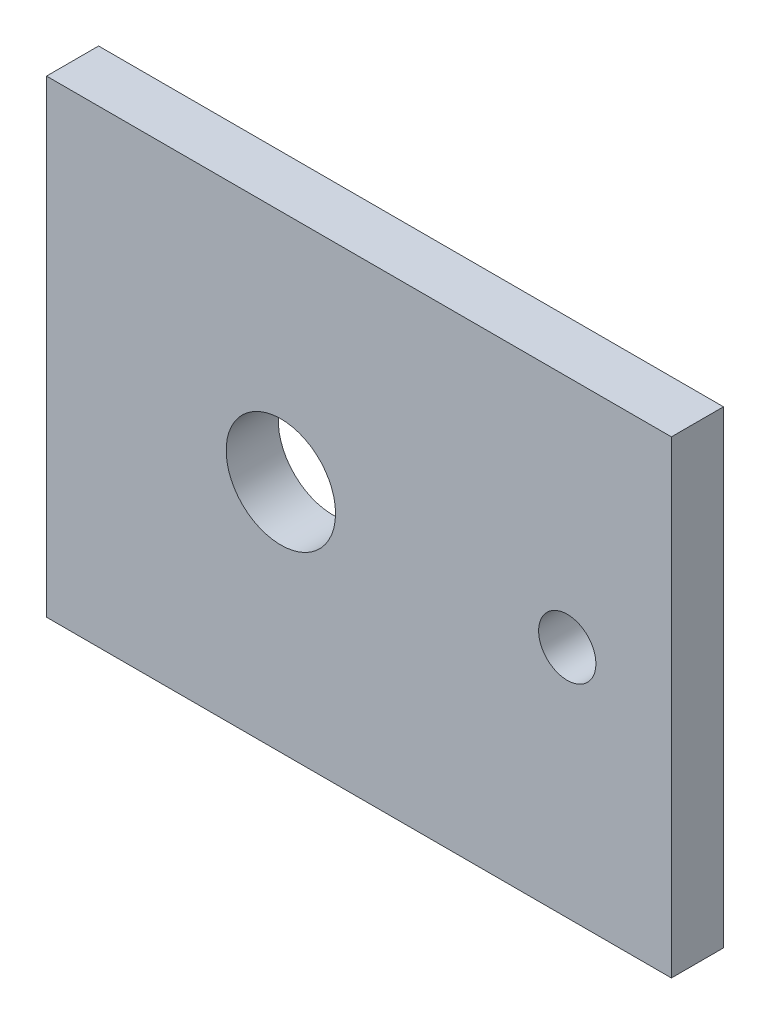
SolidWorks part; units mm, degrees
ref_plane "Plan de face" through (0, 0, 0) normal (0, 0, 1) x (1, 0, 0)
ref_plane "Plan de dessus" through (0, 0, 0) normal (0, 1, 0) x (1, 0, 0)
ref_plane "Plan de droite" through (0, 0, 0) normal (1, 0, 0) x (0, 0, -1)
sketch "Esquisse1" plane through (0, 0, 0) normal (0, 0, 1) x (1, 0, 0)
  line L0 (0, 0) -> (120, 0)
  line L1 (120, 0) -> (120, 90)
  line L2 (120, 90) -> (0, 90)
  line L3 (0, 90) -> (0, 0)
  dimension "D1" = 90
  dimension "D2" = 120
extrude "Extrusion1" add sketch "Esquisse1" along normal blind 10
sketch "Esquisse4" plane through (0, 0, 10) normal (0, 0, 1) x (1, 0, 0)
  line L0 (0, 90) -> (0, 0) construction
  line L1 (120, 90) -> (0, 90) construction
  circle A0 centre (45, 45) radius 10.5
  dimension "D1" = 45
  dimension "D3" = 21
  dimension "D2" = 45
sketch "Esquisse6" plane through (0, 0, 10) normal (0, 0, 1) x (1, 0, 0)
  line L0 (0, 90) -> (0, 0) construction
  line L1 (120, 90) -> (0, 90) construction
  circle A0 centre (100, 45) radius 5.5
  point P2 (0, 45)
  dimension "D3" = 11
  dimension "D1" = 100
  dimension "D2" = 45
extrude "Enlèv. mat.-Extru.2" cut sketch "Esquisse6" against normal through all
extrude "Enlèv. mat.-Extru.3" cut sketch "Esquisse4" against normal through all
